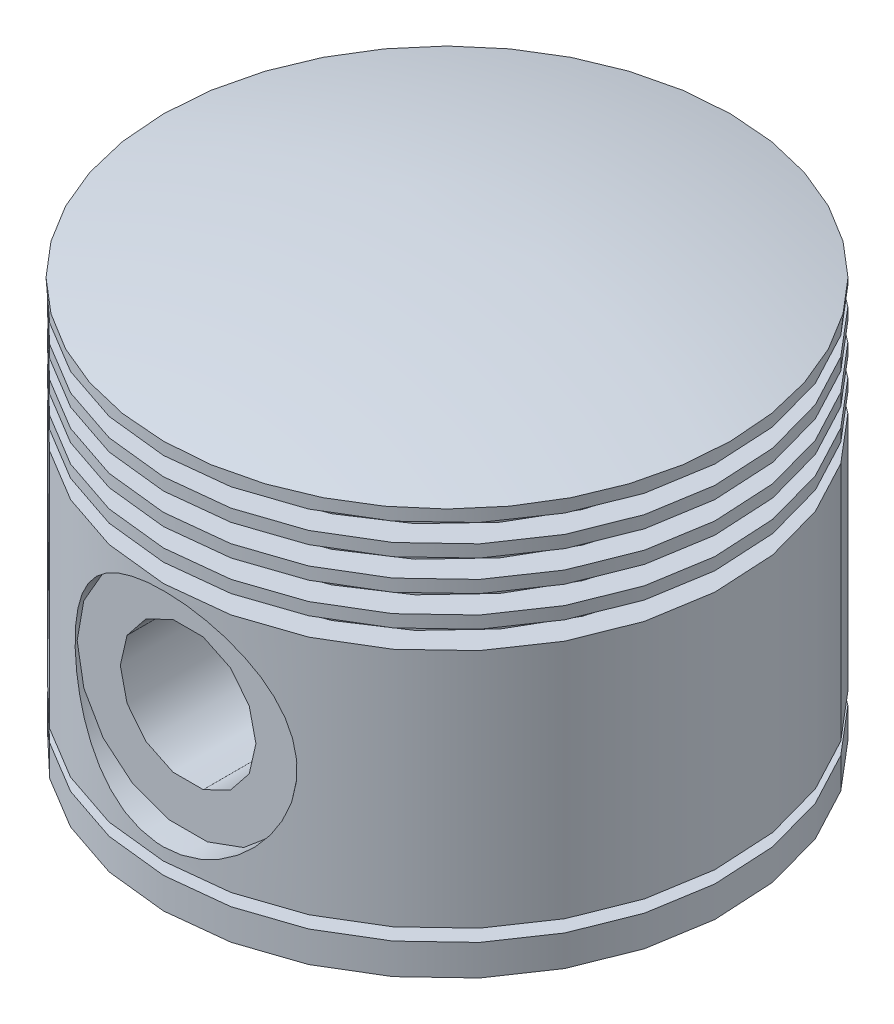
SolidWorks part; units mm, degrees
ref_plane "Front" through (0, 0, 0) normal (0, 0, 1) x (1, 0, 0)
ref_plane "Top" through (0, 0, 0) normal (0, 1, 0) x (1, 0, 0)
ref_plane "Right" through (0, 0, 0) normal (1, 0, 0) x (0, 0, -1)
sketch "Sketch1" plane through (0, 0, 0) normal (0, 0, 1) x (1, 0, 0)
  line L0 (0, 0) -> (0, -160.8294) construction
  line L1 (0, 0) -> (-30.8921, 0) construction
  line L2 (46, -5.6833) -> (46, -7.6833)
  line L3 (46, -7.6833) -> (42, -7.6833)
  line L4 (42, -7.6833) -> (42, -10.6833)
  line L5 (42, -10.6833) -> (46, -10.6833)
  line L6 (46, -10.6833) -> (46, -12.6833)
  line L7 (46, -12.6833) -> (42, -12.6833)
  line L8 (42, -12.6833) -> (42, -15.6833)
  line L9 (42, -15.6833) -> (46, -15.6833)
  line L10 (46, -15.6833) -> (46, -17.6833)
  line L11 (46, -17.6833) -> (42, -17.6833)
  line L12 (42, -17.6833) -> (42, -20.6833)
  line L13 (42, -20.6833) -> (46, -20.6833)
  line L14 (46, -20.6833) -> (46, -22.6833)
  line L15 (46, -22.6833) -> (42, -22.6833)
  line L16 (42, -22.6833) -> (42, -25.6833)
  line L17 (42, -25.6833) -> (46, -25.6833)
  line L18 (46, -25.6833) -> (46, -64.6833)
  line L19 (46, -64.6833) -> (42.5, -64.6833)
  line L20 (42.5, -64.6833) -> (42.5, -66.6833)
  line L21 (42.5, -66.6833) -> (46, -66.6833)
  line L22 (46, -66.6833) -> (46, -71.6833)
  line L23 (46, -71.6833) -> (37, -71.6833)
  line L24 (0, -9.6833) -> (0, 0)
  line L25 (37, -71.6833) -> (37, -59.6833)
  line L26 (37, -59.6833) -> (38.5, -59.6833)
  line L27 (38.5, -59.6833) -> (38.5, -29.6833)
  line L28 (38.5, -29.6833) -> (37, -29.6833)
  line L29 (37, -29.6833) -> (37, -9.6833)
  line L30 (37, -9.6833) -> (0, -9.6833)
  arc A0 (0, 0) -> (46, -5.6833) centre (0, -189) cw
  dimension "D1" = 189
  dimension "D15" = 62
  dimension "D2" = 39
  dimension "D3" = 5
  dimension "D4" = 2
  dimension "D5" = 3
  dimension "D6" = 4
  dimension "D7" = 66
  dimension "D8" = 92
  dimension "D9" = 85
  dimension "D10" = 74
  dimension "D11" = 77
  dimension "D12" = 74
  dimension "D13" = 12
  dimension "D14" = 30
revolve "Revolve1" add sketch "Sketch1" angle 360 about L0
ref_plane "Plane1" through (0, 0, 25) normal (0, 0, 1) x (1, 0, 0)
sketch "Sketch2" plane through (0, 0, 25) normal (0, 0, 1) x (1, 0, 0)
  line L0 (-46, -71.6833) -> (46, -71.6833) construction
  circle A0 centre (0, -44.6833) radius 19
  dimension "D1" = 38
  dimension "D2" = 27
extrude "Extrude1" add sketch "Sketch2" along normal up to next
mirror "Mirror1" about plane through (0, 0, 0) normal (0, 0, 1)
sketch "Sketch3" plane through (0, 0, 0) normal (1, 0, 0) x (0, 0, -1)
  line L0 (-55.5524, -44.6833) -> (53.0687, -44.6833) construction
  line L1 (-46, -71.6833) -> (46, -71.6833) construction
  line L2 (-46, -26.6833) -> (-42, -26.6833)
  line L3 (-46, -25.6833) -> (-46, -64.6833) construction
  line L4 (-42, -26.6833) -> (-42, -33.6833)
  line L5 (-42, -33.6833) -> (-25, -33.6833)
  line L6 (-25, -63.6833) -> (-25, -25.6833) construction
  line L7 (-25, -33.6833) -> (-25, -44.6833)
  line L8 (-25, -44.6833) -> (-46, -44.6833)
  line L9 (-46, -44.6833) -> (-46, -26.6833)
  dimension "D1" = 27
  dimension "D2" = 36
  dimension "D3" = 22
  dimension "D4" = 4
revolve "Cut-Revolve2" cut sketch "Sketch3" angle 360 about L0
mirror "Mirror2" about plane through (0, 0, 0) normal (0, 0, 1)
